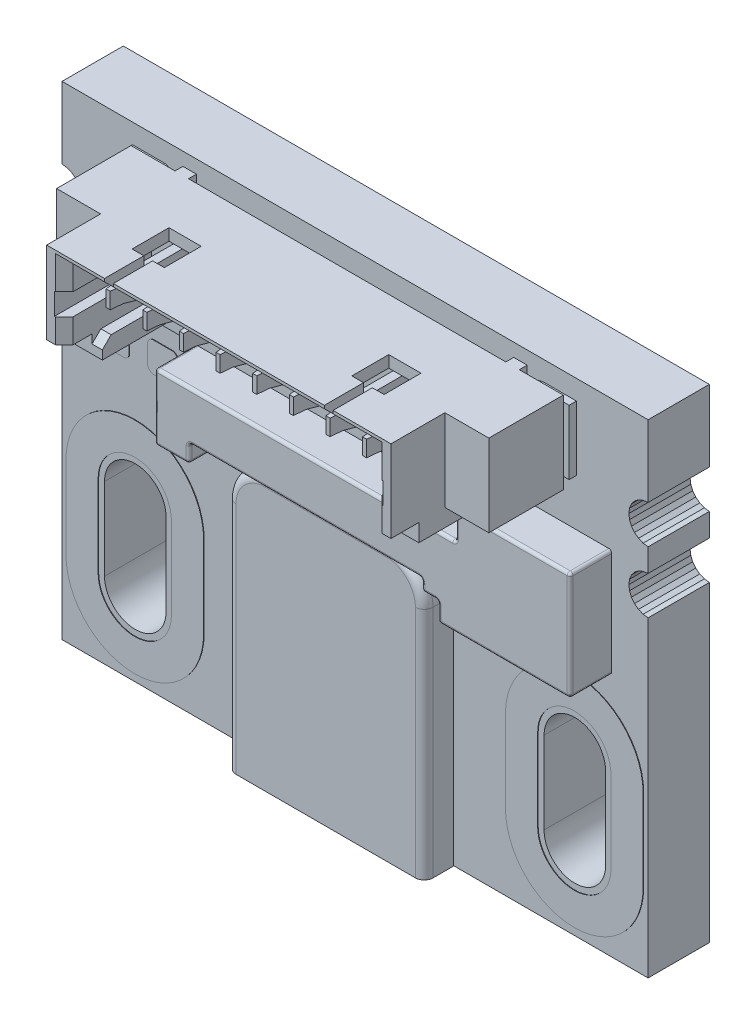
SolidWorks part; units mm, degrees
ref_plane "Front Plane" through (0, 0, 0) normal (0, 0, 1) x (1, 0, 0)
ref_plane "Top Plane" through (0, 0, 0) normal (0, 1, 0) x (1, 0, 0)
ref_plane "Right Plane" through (0, 0, 0) normal (1, 0, 0) x (0, 0, -1)
imported_body "Board.step-1/Open CASCADE STEP translator 6.8 6.1.1.step-1/Open CASCADE STEP translator 6.8 6.1.1.1.step-1-solid1"
imported_body "C9.step-1/C0402.step-1-solid1"
imported_body "C9.step-1/C0402.step-1-solid2"
imported_body "C9.step-1/C0402.step-1-solid3"
imported_body "IC3.step-1/SW3dPS-QFN32.step-1-solid1"
imported_body "IC3.step-1/SW3dPS-QFN32.step-1-solid2"
imported_body "IC3.step-1/SW3dPS-QFN32.step-1-solid3"
imported_body "IC3.step-1/SW3dPS-QFN32.step-1-solid4"
imported_body "IC3.step-1/SW3dPS-QFN32.step-1-solid5"
imported_body "IC3.step-1/SW3dPS-QFN32.step-1-solid6"
imported_body "IC3.step-1/SW3dPS-QFN32.step-1-solid7"
imported_body "IC3.step-1/SW3dPS-QFN32.step-1-solid8"
imported_body "IC3.step-1/SW3dPS-QFN32.step-1-solid9"
imported_body "IC3.step-1/SW3dPS-QFN32.step-1-solid10"
imported_body "IC3.step-1/SW3dPS-QFN32.step-1-solid11"
imported_body "IC3.step-1/SW3dPS-QFN32.step-1-solid12"
imported_body "IC3.step-1/SW3dPS-QFN32.step-1-solid13"
imported_body "IC3.step-1/SW3dPS-QFN32.step-1-solid14"
imported_body "IC3.step-1/SW3dPS-QFN32.step-1-solid15"
imported_body "IC3.step-1/SW3dPS-QFN32.step-1-solid16"
imported_body "IC3.step-1/SW3dPS-QFN32.step-1-solid17"
imported_body "IC3.step-1/SW3dPS-QFN32.step-1-solid18"
imported_body "IC3.step-1/SW3dPS-QFN32.step-1-solid19"
imported_body "IC3.step-1/SW3dPS-QFN32.step-1-solid20"
imported_body "IC3.step-1/SW3dPS-QFN32.step-1-solid21"
imported_body "IC3.step-1/SW3dPS-QFN32.step-1-solid22"
imported_body "IC3.step-1/SW3dPS-QFN32.step-1-solid23"
imported_body "IC3.step-1/SW3dPS-QFN32.step-1-solid24"
imported_body "IC3.step-1/SW3dPS-QFN32.step-1-solid25"
imported_body "IC3.step-1/SW3dPS-QFN32.step-1-solid26"
imported_body "IC3.step-1/SW3dPS-QFN32.step-1-solid27"
imported_body "IC3.step-1/SW3dPS-QFN32.step-1-solid28"
imported_body "IC3.step-1/SW3dPS-QFN32.step-1-solid29"
imported_body "IC3.step-1/SW3dPS-QFN32.step-1-solid30"
imported_body "IC3.step-1/SW3dPS-QFN32.step-1-solid31"
imported_body "IC3.step-1/SW3dPS-QFN32.step-1-solid32"
imported_body "IC3.step-1/SW3dPS-QFN32.step-1-solid33"
imported_body "IC3.step-1/SW3dPS-QFN32.step-1-solid34"
imported_body "C4.step-1/C0402.step-1-solid1"
imported_body "C4.step-1/C0402.step-1-solid2"
imported_body "C4.step-1/C0402.step-1-solid3"
imported_body "C1.step-1/Cap_Samsung_Electro-Mechanics_America,_Inc_CL21B106KOQNNNE_eec.step-1/Taiyo_Yuden_UMK107AB7105KA-T1_-_Copy.step-1-solid1"
imported_body "C1.step-1/Cap_Samsung_Electro-Mechanics_America,_Inc_CL21B106KOQNNNE_eec.step-1/Taiyo_Yuden_UMK107AB7105KA-T1.step-1-solid1"
imported_body "C1.step-1/Cap_Samsung_Electro-Mechanics_America,_Inc_CL21B106KOQNNNE_eec.step-1/Taiyo_Yuden_UMK107AB7105KA-T1.step-1-solid2"
imported_body "C1.step-1/Cap_Samsung_Electro-Mechanics_America,_Inc_CL21B106KOQNNNE_eec.step-1/Samsung_ss.step-1-solid1"
imported_body "C3.step-1/C0402.step-1-solid1"
imported_body "C3.step-1/C0402.step-1-solid2"
imported_body "C3.step-1/C0402.step-1-solid3"
imported_body "IC5.step-1/SOT353.step-1-solid1"
imported_body "TP1.step-1/10103100480.step-1/Extruded.step-1-solid1"
imported_body "TP2.step-1/10103100480.step-1/Extruded.step-1-solid1"
imported_body "K1.step-1/10114828-XXX08LFc2.step-1-solid1"
imported_body "C2.step-1/C0402.step-1-solid1"
imported_body "C2.step-1/C0402.step-1-solid2"
imported_body "C2.step-1/C0402.step-1-solid3"
imported_body "C5.step-1/C0402.step-1-solid1"
imported_body "C5.step-1/C0402.step-1-solid2"
imported_body "C5.step-1/C0402.step-1-solid3"
imported_body "C6.step-1/C0402.step-1-solid1"
imported_body "C6.step-1/C0402.step-1-solid2"
imported_body "C6.step-1/C0402.step-1-solid3"
imported_body "C7.step-1/C0402.step-1-solid1"
imported_body "C7.step-1/C0402.step-1-solid2"
imported_body "C7.step-1/C0402.step-1-solid3"
imported_body "D1.step-1/SW3dPS-SOD-323.step-1-solid1"
imported_body "L1.step-1/User_Library-FB_1608.step-1/Pad001.step-1-solid1"
imported_body "L1.step-1/User_Library-FB_1608.step-1/Cut.step-1-solid1"
imported_body "L1.step-1/User_Library-FB_1608.step-1/Cut.step-1-solid2"
imported_body "C8.step-1/C0402.step-1-solid1"
imported_body "C8.step-1/C0402.step-1-solid2"
imported_body "C8.step-1/C0402.step-1-solid3"
imported_body "Free-Models.step-1/10363966848.step-1/Extruded-0.step-1-solid1"
imported_body "Free-Models.step-1/10365572320.step-1/Extruded-1.step-1-solid1"
imported_body "Free-Models.step-1/Zalivka.step-1-solid1"
imported_body "Free-Models.step-1/Partz_RGB4408131.step-1-solid1"
imported_body "Free-Models.step-1/elongated1_RGB3326705.step-1-solid1"
imported_body "Free-Models.step-1/elongated1_RGB3326705.step-2-solid1"
imported_body "Free-Models.step-1/elongated1_RGB3326705.step-3-solid1"
imported_body "Free-Models.step-1/elongated1_RGB3326705.step-4-solid1"
sketch "Sketch1" plane through (0, 0, -2.7903) normal (0, 0, -1) x (-1, 0, 0)
  line L1 (-11.295, 11.675) -> (-6.295, 11.675)
  line L2 (-11.295, 11.675) -> (-11.295, 6.675)
  line L3 (-11.295, 6.675) -> (-6.295, 6.675)
  line L4 (-6.295, 11.675) -> (-6.295, 6.675)
  line L5 (-11.295, 11.675) -> (-6.295, 6.675) construction
  line L6 (-11.295, 6.675) -> (-6.295, 11.675) construction
  circle A0 centre (-6.5877, 6.9754) radius 0.1348
  point P4 (-8.795, 9.175)
extrude "Boss-Extrude1" add sketch "Sketch1" along normal blind 0.001
sketch "Sketch3" plane through (0, 0, -2.0903) normal (0, 0, -1) x (-1, 0, 0)
  line L10 (-0.8657, 12.4593) -> (-13.3, 12.4593)
  line L11 (-8.8, 1.775) -> (-8.8, 4.5602) construction
  line L12 (-13.3, 2.5786) -> (-13.3, 12.4593)
  line L14 (-4.3, 10.1749) -> (-0.8657, 10.1749)
  line L15 (1.2, 1.775) -> (-18.8, 1.775) construction
  line L17 (-0.8657, 12.4593) -> (-0.8657, 10.1749)
  line L21 (-4.3, 2.5786) -> (-4.3, 10.1749)
  line L22 (-13.3, 2.5786) -> (-12.4, 2.5786)
  line L24 (-12.4, 2.5786) -> (-12.4, 6.575)
  line L25 (-12.4, 6.575) -> (-5.2, 6.575)
  line L26 (-5.2, 2.5786) -> (-4.3, 2.5786)
  line L28 (-1.036, 10.942) -> (-1.036, 11.558) construction
  line L29 (-11.295, 6.675) -> (-6.295, 6.675) construction
  line L30 (-5.2, 2.5786) -> (-5.2, 6.575)
  line L31 (-3.8783, 10.2749) -> (-2.8215, 10.2749) construction
  line L32 (-2.9287, 12.2677) -> (-3.7711, 12.2677) construction
  dimension "D1" = 7.2
  dimension "D2" = 0.1703
  dimension "D3" = 9
  dimension "D4" = 0.1
  dimension "D5" = 0.1004
  dimension "D6" = 0.1
  dimension "D7" = 0.1916
extrude "Boss-Extrude2" add sketch "Sketch3" along normal blind 1
sketch "Sketch4" plane through (0, 0, 0) normal (0, 0, 1) x (1, 0, 0)
  line L0 (17.1207, 10.1069) -> (17.5598, 10.1095)
  line L2 (17.5598, 10.1095) -> (17.5598, 13.8)
  line L3 (17.5598, 13.8) -> (13.65, 13.8)
  line L4 (13.65, 12.809) -> (13.65, 13.8)
  line L6 (17.1207, 10.1069) -> (13.054, 10.1069)
  line L7 (13.054, 10.1069) -> (13.054, 10.7607)
  line L8 (13.054, 10.7607) -> (12.4987, 10.7607)
  line L9 (12.4987, 10.7607) -> (12.4987, 11.1493)
  line L10 (12.4987, 11.1493) -> (4.5569, 11.1493)
  line L11 (4.5569, 11.1493) -> (4.5569, 10.5346)
  line L12 (4.5569, 10.5346) -> (3.3846, 10.5346)
  line L13 (3.3846, 10.5346) -> (3.3846, 12.809)
  line L14 (3.3846, 12.809) -> (13.65, 12.809)
extrude "Boss-Extrude3" add sketch "Sketch4" along normal blind 1.42
fillet "Fillet1" radius 0.1 26 edges at (15.0873, 10.1069, 1.42) (17.3402, 10.1082, 1.42) (17.5598, 11.9548, 1.42) (15.6049, 13.8, 1.42) (13.65, 13.3045, 1.42) (8.5173, 12.809, 1.42) (3.3846, 11.6718, 1.42) (3.9707, 10.5346, 1.42) (4.5569, 10.842, 1.42) (12.4987, 10.955, 1.42) (12.7764, 10.7607, 1.42) (13.054, 10.4338, 1.42) (8.5278, 11.1493, 1.42) (17.5598, 13.8, 0.71) (13.65, 13.8, 0.71) (13.65, 12.809, 0.71) (3.3846, 12.809, 0.71) (3.3846, 10.5346, 0.71) (4.5569, 10.5346, 0.71) (4.5569, 11.1493, 0.71) (12.4987, 11.1493, 0.71) (12.4987, 10.7607, 0.71) (13.054, 10.7607, 0.71) (13.054, 10.1069, 0.71) (17.1207, 10.1069, 0.71) (17.5598, 10.1095, 0.71)
fillet "Fillet2" radius 0.1 20 edges at (8.8, 6.575, -3.0903) (12.4, 4.5768, -3.0903) (12.85, 2.5786, -3.0903) (13.3, 7.519, -3.0903) (7.0828, 12.4593, -3.0903) (0.8657, 11.3171, -3.0903) (2.5828, 10.1749, -3.0903) (4.3, 6.3768, -3.0903) (4.75, 2.5786, -3.0903) (5.2, 4.5768, -3.0903) (5.2, 2.5786, -2.5903) (4.3, 10.1749, -2.5903) (0.8657, 10.1749, -2.5903) (0.8657, 12.4593, -2.5903) (13.3, 12.4593, -2.5903) (13.3, 2.5786, -2.5903) (12.4, 2.5786, -2.5903) (12.4, 6.575, -2.5903) (5.2, 6.575, -2.5903) (4.3, 2.5786, -2.5903)
